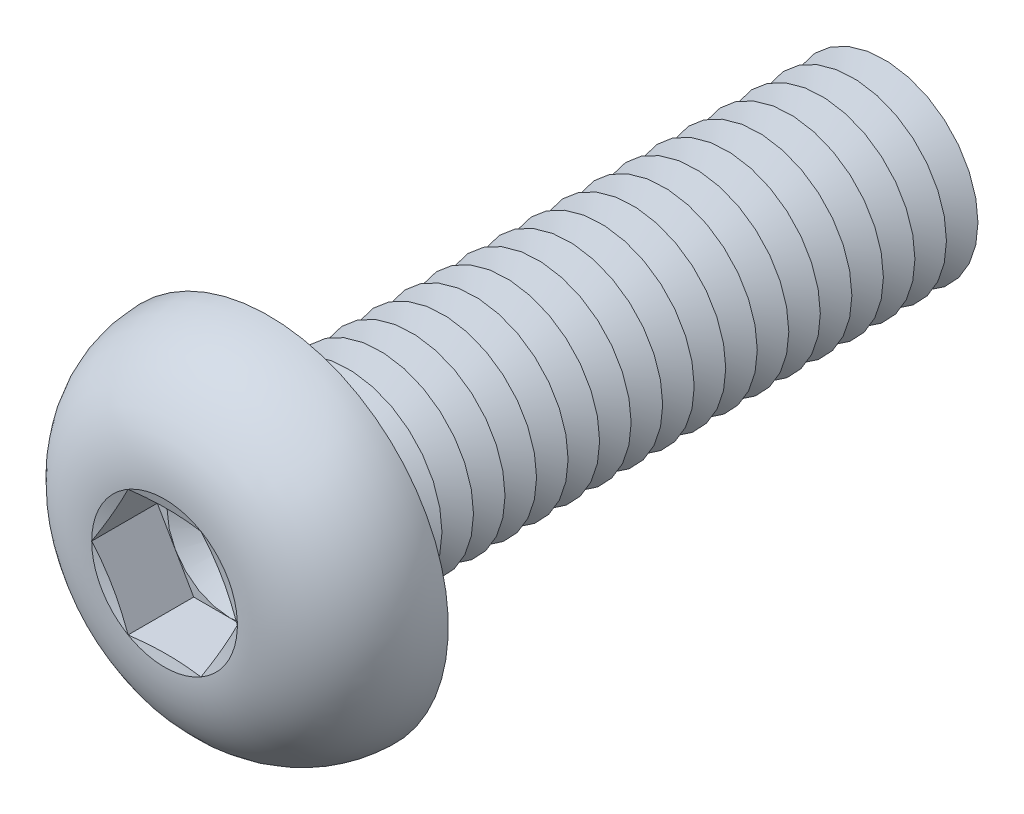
SolidWorks part; units mm, degrees
ref_plane "Front Plane" through (0, 0, 0) normal (0, 0, 1) x (1, 0, 0)
ref_plane "Top Plane" through (0, 0, 0) normal (0, 1, 0) x (1, 0, 0)
ref_plane "Right Plane" through (0, 0, 0) normal (1, 0, 0) x (0, 0, -1)
sketch "Sketch1" plane through (0, 0, 0) normal (1, 0, 0) x (0, 0, -1)
  line L0 (0, 1.5) -> (0, 2.85)
  line L3 (0, 1.5) -> (10, 1.5)
  line L4 (10, 1.5) -> (10, 0)
  line L5 (10, 0) -> (-1.65, 0) construction
  line L6 (-1.65, 0) -> (10, 0)
  line L7 (-1.65, 1.1547) -> (-1.65, 0.5773) construction
  line L8 (-1.65, 0.5773) -> (-1.65, 0)
  line L9 (-1.65, 1.1547) -> (-1.4953, 0.5773)
  line L10 (-1.4953, 0.5773) -> (-1.65, 0.5773)
  line L11 (10, 0) -> (22.7481, 0) construction
  line L12 (0, 2.85) -> (-1.65, 2.85) construction
  arc A1 (0, 2.85) -> (-1.65, 1.1547) centre (0, 1.1994) ccw
  point P8 (10, 0.75)
  dimension "D1" = 5.7
  dimension "D2" = 3
  dimension "D3" = 1.65
  dimension "D4" = 2.3094
  dimension "D5" = 10
  dimension "D6" = 15
revolve "Revolve1" add sketch "Sketch1" angle 360 about L5
fillet "Fillet1" radius 0.25 1 edges at (-1.5, 0, 0)
sketch "Sketch2" plane through (0, 0, 0) normal (1, 0, 0) x (0, 0, -1)
  line L0 (9.75, 1.5) -> (10.25, 1.5)
  line L1 (10, 1.5) -> (0.25, 1.5) construction
  line L2 (10.25, 1.5) -> (10, 1.067)
  line L3 (10, -1.5) -> (10, 1.5) construction
  line L4 (10, 1.067) -> (9.75, 1.5)
  dimension "D1" = 0.5
revolve "Cut-Revolve1" cut sketch "Sketch2" angle 360 about axis through (0, 0, -10) along (0, 0, -1)
pattern_linear "LPattern1" count 20 spacing 0.5 along (0, 0, 1) of "Cut-Revolve1"
sketch "Sketch3" plane through (0, 0, 1.65) normal (0, 0, 1) x (1, 0, 0)
  line L7 (0.5773, 1) -> (-0.5774, 1)
  line L8 (-0.5774, 1) -> (-1.1547, 0)
  line L9 (-1.1547, 0) -> (-0.5773, -1)
  line L10 (-0.5773, -1) -> (0.5773, -1)
  line L11 (0.5773, -1) -> (1.1547, 0)
  line L12 (1.1547, 0) -> (0.5773, 1)
  circle A0 centre (0, 0) radius 1 construction
  circle A3 centre (0, 0) radius 1.1547 construction
extrude "Cut-Extrude1" cut sketch "Sketch3" against normal blind 1.04
sketch "Sketch4" plane through (0, 0, 0.61) normal (0, 0, 1) x (1, 0, 0)
  line L1 (0.5773, 1) -> (-0.5774, 1) construction
  circle A0 centre (0, 0) radius 1
extrude "Cut-Extrude2" cut sketch "Sketch4" against normal through all draft 60
